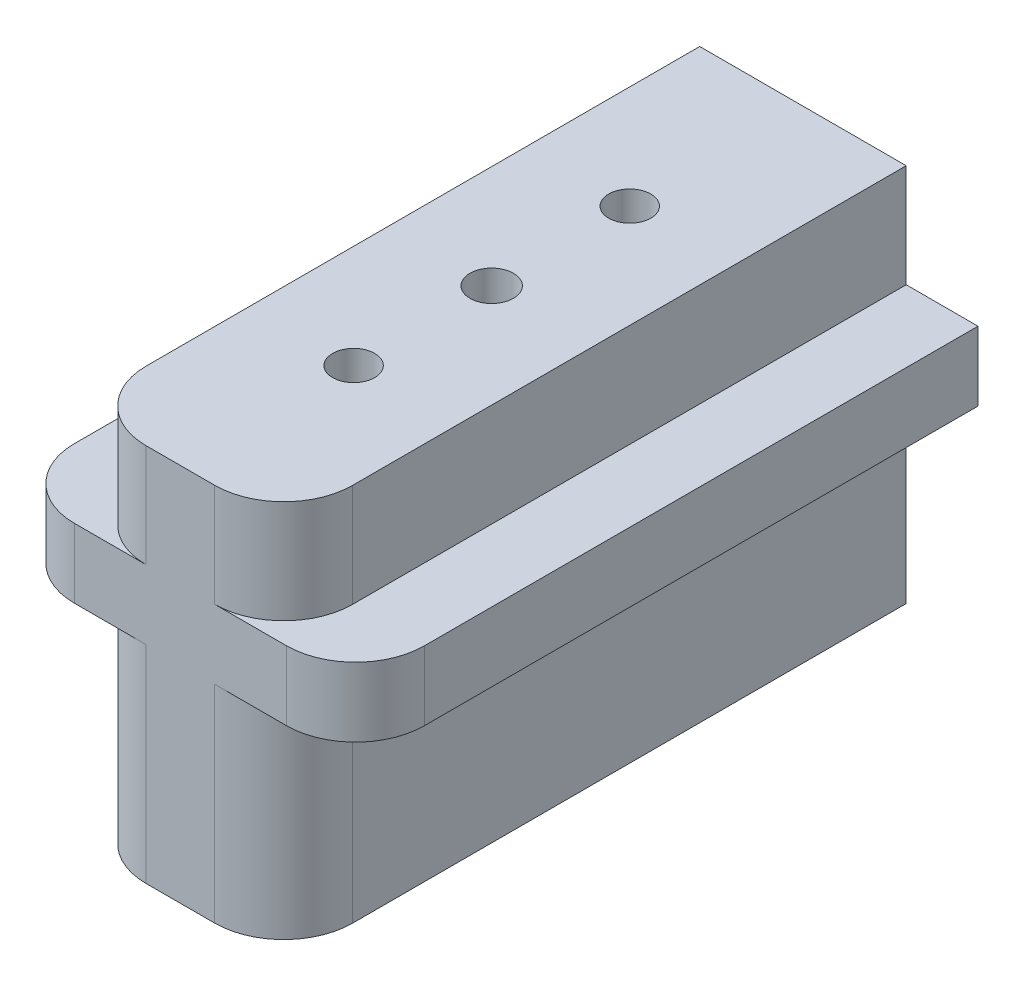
SolidWorks part; units mm, degrees
ref_plane "Front/Back" through (0, 0, 0) normal (0, 0, 1) x (1, 0, 0)
ref_plane "Top/Bottom" through (0, 0, 0) normal (0, 1, 0) x (1, 0, 0)
ref_plane "Right/Left" through (0, 0, 0) normal (1, 0, 0) x (0, 0, -1)
sketch "Sketch1" plane through (0, 0, 0) normal (0, 1, 0) x (1, 0, 0)
  line L0 (0, 0) -> (7.1247, 0) construction
  line L1 (-7.1247, 21.4757) -> (7.1247, 21.4757)
  line L2 (-7.1247, 21.4757) -> (-7.1247, -21.4757)
  line L3 (-7.1247, -21.4757) -> (7.1247, -21.4757)
  line L4 (7.1247, 21.4757) -> (7.1247, -21.4757)
  line L5 (0, 0) -> (0, 21.4757) construction
  dimension "D1" = 14.2494
  dimension "D2" = 42.9514
extrude "Extrude1" add sketch "Sketch1" along normal mid plane 26.162
sketch "Sketch2" plane through (0, 13.081, 0) normal (0, 1, 0) x (-1, 0, 0)
  line L0 (-7.1247, -21.4757) -> (7.1247, -21.4757) construction
  line L1 (-12.0777, -21.4757) -> (12.0777, -21.4757)
  line L2 (-12.0777, -21.4757) -> (-12.0777, 21.4757)
  line L3 (-12.0777, 21.4757) -> (12.0777, 21.4757)
  line L4 (12.0777, -21.4757) -> (12.0777, 21.4757)
  line L5 (0, 0) -> (0, 13.6166) construction
  line L6 (0, 0) -> (8.6765, 0) construction
  line L7 (7.1247, 21.4757) -> (-7.1247, 21.4757) construction
  dimension "D2" = 24.1554
extrude "Extrude2" add sketch "Sketch2" along normal blind 4.7752 from offset 11.8872
fillet "Fillet1" radius 4.7625 4 edges at (7.1247, -5.9436, 21.4757) (7.1247, 9.525, 21.4757) (-7.1247, 9.525, 21.4757) (-7.1247, -5.9436, 21.4757)
fillet "Fillet2" radius 4.7625 2 edges at (12.0777, 3.5814, 21.4757) (-12.0777, 3.5814, 21.4757)
sketch "Sketch3" plane through (0, 13.081, 0) normal (0, 1, 0) x (1, 0, 0)
  point P0 (0, -9.525)
  point P1 (0, 9.525)
  point P2 (0, 0)
  dimension "D1" = 9.525
  dimension "D2" = 19.05
hole_wizard "M3.5x0.6 Tapped Hole1" positions "3DSketch1" profile "Sketch4" tap size "M3.5x0.6" standard "Ansi Metric"
sketch3d "3DSketch1"
  point P0 (0, 13.081, 9.525)
  point P2 (0, 13.081, -9.525)
sketch "Sketch4" plane through (0, 13.081, 9.525) normal (1, 0, 0) x (0, 0, 1)
  line L0 (0, 0) -> (0, 10.5212)
  line L1 (0, 10.5212) -> (1.45, 9.65)
  line L2 (1.45, 9.65) -> (1.45, 0)
  line L5 (1.45, 0) -> (0, 0)
  line L10 (0, 10.5212) -> (-1.45, 9.65) construction
  line L11 (0, -6.35) -> (0, 107.95) construction
  dimension "Tap Drill Dia." = 2.9
  dimension "Tap Drill Depth" = 9.65
  dimension "Drill Angle" = 118
hole_wizard "Ø3.0 (3) Diameter Hole1" positions "3DSketch2" profile "Sketch5" hole size "Ø3.0" standard "Ansi Metric"
sketch3d "3DSketch2"
  point P0 (0, 13.081, 0)
sketch "Sketch5" plane through (0, 13.081, 0) normal (1, 0, 0) x (0, 0, 1)
  line L0 (0, 0) -> (0, 6.9013)
  line L1 (0, 6.9013) -> (1.5, 6)
  line L2 (1.5, 6) -> (1.5, 0)
  line L5 (1.5, 0) -> (0, 0)
  line L10 (0, 6.9013) -> (-1.5, 6) construction
  line L11 (0, -6.35) -> (0, 107.95) construction
  dimension "Hole Dia." = 3
  dimension "Hole Depth" = 6
  dimension "Drill Angle" = 118
